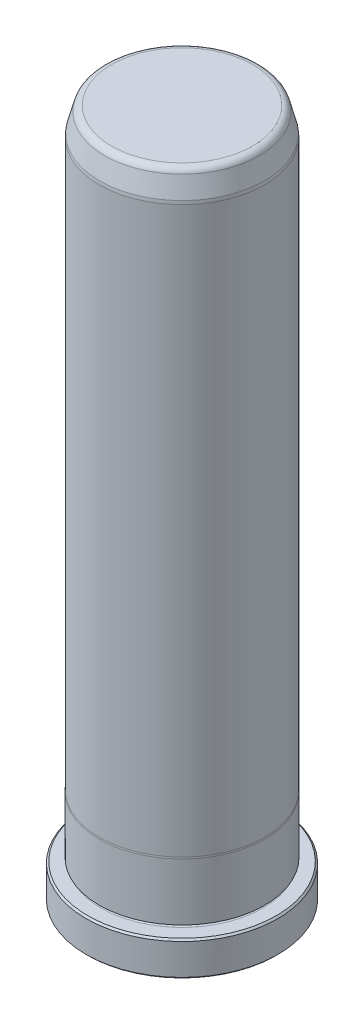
SolidWorks part; units mm, degrees
ref_plane "Front Plane" through (0, 0, 0) normal (0, 0, 1) x (1, 0, 0)
ref_plane "Top Plane" through (0, 0, 0) normal (0, 1, 0) x (1, 0, 0)
ref_plane "Right Plane" through (0, 0, 0) normal (1, 0, 0) x (0, 0, -1)
sketch "Sketch1" plane through (0, 0, 0) normal (1, 0, 0) x (0, 0, -1)
  line L0 (0, 0) -> (22.098, 0)
  line L1 (22.098, 0) -> (22.098, 7.9248)
  line L2 (22.098, 7.9248) -> (18.6563, 7.9248)
  line L3 (18.2753, 4.7498) -> (18.2753, 5.5118) construction
  line L4 (18.6563, 8.6868) -> (19.0627, 8.6868)
  line L5 (19.0627, 8.6868) -> (19.0627, 21.8618)
  line L6 (19.0627, 21.8618) -> (19.0373, 22.225)
  line L7 (19.0373, 22.225) -> (19.0373, 152.4)
  line L9 (17.4733, 158.75) -> (0, 158.75)
  line L10 (0, 158.75) -> (0, 0)
  line L11 (0, 0) -> (0, -13.6287) construction
  line L12 (19.0373, 152.4) -> (18.9706, 153.162)
  line L13 (18.9706, 153.162) -> (17.4733, 158.75)
  arc A0 (18.6563, 8.6868) -> (18.6563, 7.9248) centre (18.6563, 8.3058) ccw
  dimension "D14" = 0.762
  dimension "T" = 7.9248
  dimension "D2" = 0.762
  dimension "M" = 44.196
  dimension "B" = 38.1254
  dimension "L" = 158.75
  dimension "D7" = 0.7874
  dimension "A" = 22.225
  dimension "D8" = 4
  dimension "D10" = 5
  dimension "D11" = 15
  dimension "D12" = 0.762
  dimension "K" = 6.35
  dimension "D" = 38.0746
revolve "Revolve1" add sketch "Sketch1" angle 360 about L11
fillet "Fillet6" radius 1.5875 1 edges at (0, 158.75, 17.4733)
chamfer "Chamfer1" distance 0.381 angle 45 2 edges at (0, 0, 22.098) (0, 7.9248, 22.098)
